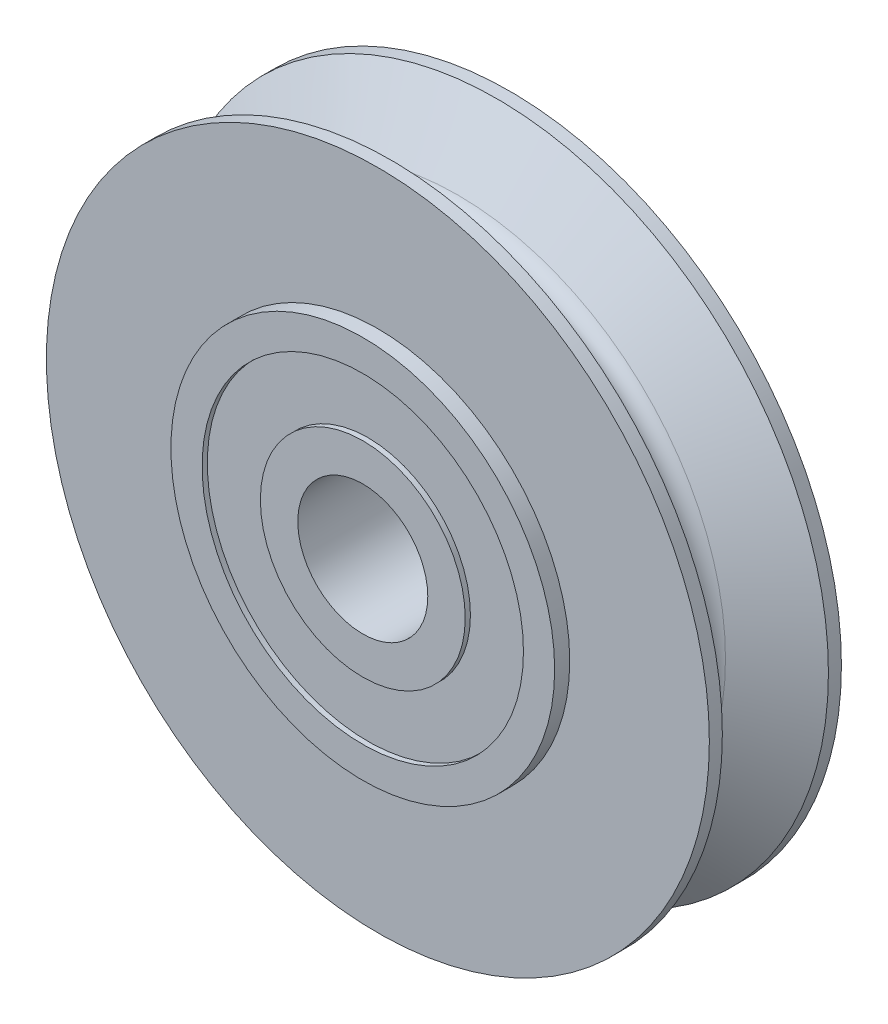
SolidWorks part; units mm, degrees
ref_plane "Front" through (0, 0, 0) normal (0, 0, 1) x (1, 0, 0)
ref_plane "Top" through (0, 0, 0) normal (0, 1, 0) x (1, 0, 0)
ref_plane "Right" through (0, 0, 0) normal (1, 0, 0) x (0, 0, -1)
sketch "Sketch1" plane through (0, 0, 0) normal (1, 0, 0) x (0, 0, -1)
  line L0 (1.2954, 8.0963) -> (1.6129, 8.0962)
  line L1 (-1.2954, 8.0963) -> (-1.6129, 8.0962)
  line L2 (-1.2954, 8.0963) -> (-0.3381, 6.539)
  line L3 (-1.6129, 4.6863) -> (-1.9812, 4.6863)
  line L4 (1.9812, 1.5875) -> (-1.9812, 1.5875)
  line L5 (-1.9812, 4.6863) -> (-1.9812, 3.9243)
  line L6 (1.2954, 8.0963) -> (0.3381, 6.539)
  line L7 (-1.9812, 3.9243) -> (-1.8542, 3.9243)
  line L8 (-1.5875, 0) -> (1.5875, 0) construction
  line L9 (-1.6129, 4.6863) -> (-1.6129, 8.0962)
  line L10 (1.6129, 8.0962) -> (1.6129, 4.6863)
  line L11 (-1.8542, 2.5019) -> (-1.9812, 2.5019)
  line L12 (-1.9812, 2.5019) -> (-1.9812, 1.5875)
  line L13 (-1.8542, 3.9243) -> (-1.8542, 2.5019)
  line L14 (0, 6.35) -> (0, -6.35) construction
  line L15 (1.9812, 2.5019) -> (1.9812, 1.5875)
  line L16 (1.8542, 2.5019) -> (1.9812, 2.5019)
  line L17 (-1.6129, 8.0962) -> (-1.6129, -8.0962) construction
  line L18 (1.8542, 3.9243) -> (1.8542, 2.5019)
  line L19 (1.9812, 3.9243) -> (1.8542, 3.9243)
  line L20 (1.9812, 4.6863) -> (1.9812, 3.9243)
  line L21 (1.6129, 4.6863) -> (1.9812, 4.6863)
  line L22 (-3.2379, 6.35) -> (4.1174, 6.35) construction
  arc A0 (-0.3381, 6.539) -> (0.3381, 6.539) centre (0, 6.7469) ccw
  circle A1 centre (0, 6.7469) radius 0.3969 construction
  circle A2 centre (0, 0) radius 1.5875 construction
  circle A3 centre (0, 0) radius 2.3813 construction
  circle A4 centre (0, 2.3813) radius 0.0556
  circle A5 centre (0, -6.7469) radius 0.3969 construction
  point P28 (-1.6129, 0)
  point P33 (-1.9812, 4.3053)
revolve "Revolve1" add sketch "Sketch1" angle 360 about L8
sketch "Sketch2" [suppressed] plane through (0, 0, 0) normal (0, 0, 1) x (1, 0, 0)
  circle A0 centre (0, 0) radius 2.3812 construction
  circle A1 centre (0, 0) radius 2.3812
extrude "Cut-Extrude-Thin1" [suppressed] cut sketch "Sketch2" against normal through all and the other way through all thin
sketch "Sketch3" plane through (0, 0, 0) normal (1, 0, 0) x (0, 0, -1)
  line L0 (0, 2.4368) -> (0, 2.3257)
  circle A0 centre (0, 2.3813) radius 0.0556 construction
  arc A1 (0, 2.3257) -> (0, 2.4368) centre (0, 2.3813) ccw
revolve "Revolve2" add sketch "Sketch3" angle 360 about L0
chamfer "Chamfer2" [suppressed] distance 0.762 angle 45
pattern_circular "CirPattern1" count 20 over 360 about axis through (0, 0, 0) along (0, 0, 1)
sketch "Sketch4" plane through (0, 0, 0) normal (0, 0, 1) x (1, 0, 0)
  line L0 (-12.7961, 6.35) -> (12.9895, 6.35) construction
  line L1 (-6.35, 8.7241) -> (-6.35, -9.5699) construction
  circle A0 centre (0, 0) radius 6.35 construction
ref_plane "Plane1" through (0, 6.35, 0) normal (0, 1, 0) x (1, 0, 0)
ref_plane "Plane2" through (-6.35, 0, 0) normal (1, 0, 0) x (0, 0, -1)
equation "\"D8@Sketch1\" = \"Wd@Sketch1\" * .1"
equation "\"D1@Sketch1\" = \"Shaft Dia@Sketch1\" * 1.5"
equation "\"D1@Chamfer2\" = \"D5@Sketch1\""
equation "\"D6@Sketch1\" = \"D2@Sketch1\" * .875"
